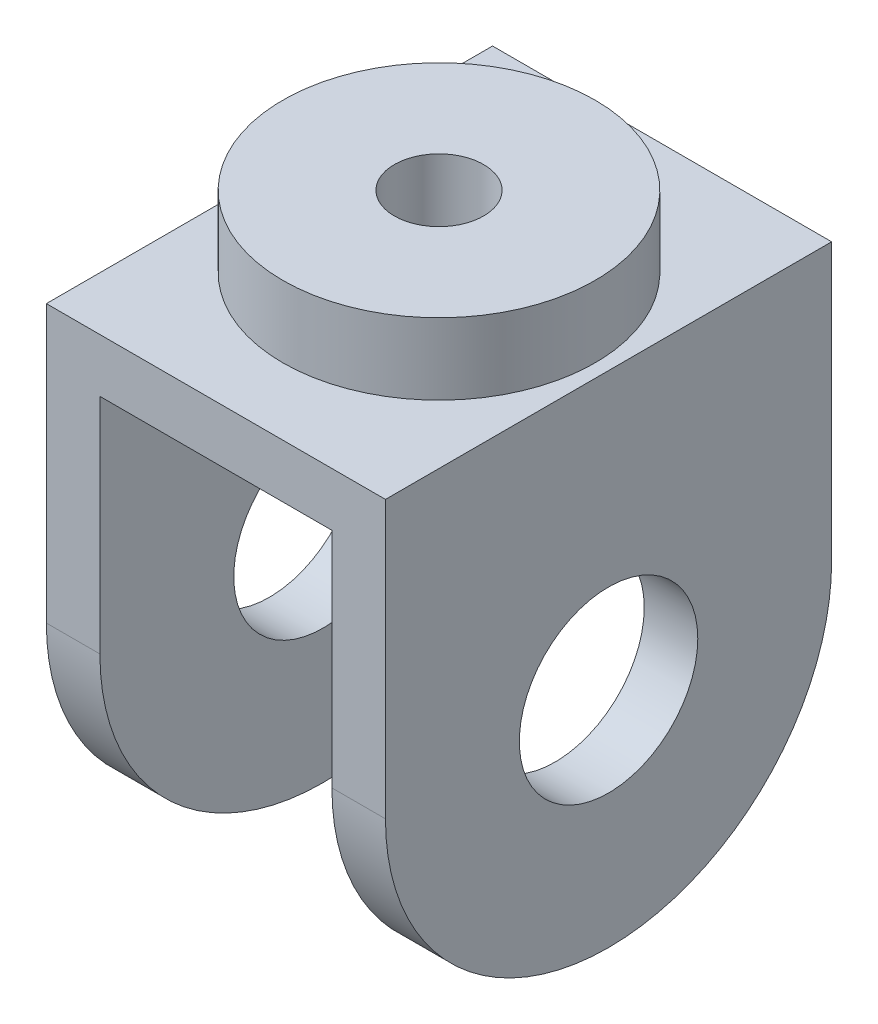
SolidWorks part; units mm, degrees
ref_plane "Front Plane" through (0, 0, 0) normal (0, 0, 1) x (1, 0, 0)
ref_plane "Top Plane" through (0, 0, 0) normal (0, 1, 0) x (1, 0, 0)
ref_plane "Right Plane" through (0, 0, 0) normal (1, 0, 0) x (0, 0, -1)
sketch "Sketch1" plane through (0, 0, 0) normal (1, 0, 0) x (0, 0, -1)
  line L0 (-41.9739, 0) -> (35.1158, 0) construction
  line L2 (-25, 0) -> (-25, 25)
  line L3 (-25, 25) -> (25, 25)
  line L4 (25, 0) -> (25, 25)
  circle A0 centre (0, 0) radius 10
  arc A1 (-25, 0) -> (25, 0) centre (0, 0) ccw
  point P0 (0, 0)
  dimension "D3" = 20
  dimension "D1" = 50
  dimension "D2" = 25
extrude "Boss-Extrude1" add sketch "Sketch1" along normal blind 6
ref_plane "Plane1" through (-19, 0, 0) normal (1, 0, 0) x (0, 0, -1)
sketch "Sketch2" plane through (0, 25, 0) normal (0, 1, 0) x (1, 0, 0)
  line L2 (6, -25) -> (-32, -25)
  line L3 (6, -25) -> (6, 25)
  line L4 (6, 25) -> (-32, 25)
  line L9 (-32, -25) -> (-32, 25)
  dimension "D1" = 50
  dimension "D2" = 38
extrude "Boss-Extrude2" add sketch "Sketch2" along normal blind 6
sketch "Sketch3" plane through (0, 31, 0) normal (0, 1, 0) x (1, 0, 0)
  line L0 (-32, 25) -> (6, -25) construction
  line L1 (6, 25) -> (-32, -25) construction
  circle A1 centre (-13, 0) radius 17.5
  dimension "D1" = 35
extrude "Boss-Extrude3" add sketch "Sketch3" along normal blind 8
sketch "Sketch4" plane through (0, 39, 0) normal (0, 1, 0) x (1, 0, 0)
  circle A0 centre (-13, 0) radius 5
  dimension "D1" = 10
extrude "Cut-Extrude1" cut sketch "Sketch4" against normal through all
ref_plane "Plane2" through (-13, 0, 0) normal (1, 0, 0) x (0, 0, -1)
mirror "Mirror1" about plane through (-13, 0, 0) normal (1, 0, 0) of "Boss-Extrude1"
